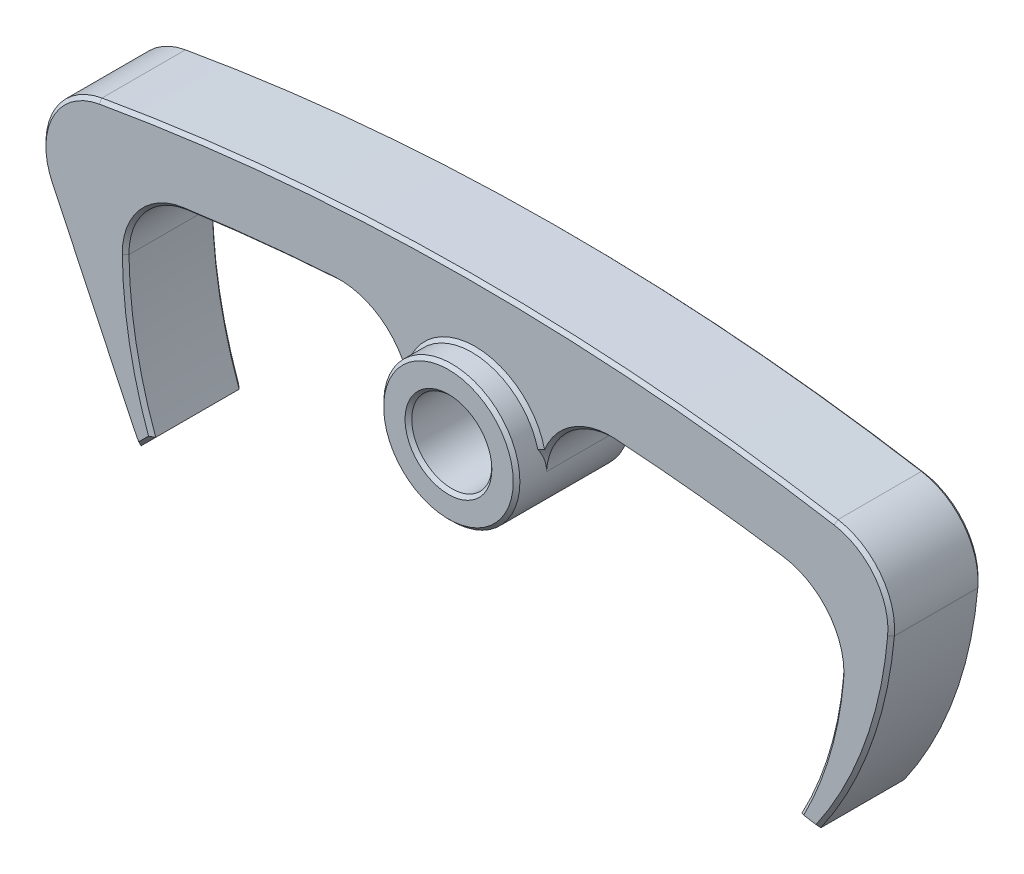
SolidWorks part; units mm, degrees
ref_plane "Спереди" through (0, 0, 0) normal (0, 0, 1) x (1, 0, 0)
ref_plane "Сверху" through (0, 0, 0) normal (0, 1, 0) x (1, 0, 0)
ref_plane "Справа" through (0, 0, 0) normal (1, 0, 0) x (0, 0, -1)
sketch "Эскиз1" plane through (0, 0, 0) normal (0, 0, 1) x (1, 0, 0)
  line L0 (0, 0) -> (0, -9.705) construction
  line L1 (-40.3695, -9.705) -> (40.3695, -9.705) construction
  line L2 (-5.0875, -5) -> (4.1894, -5) construction
  line L3 (24.2206, -22.6439) -> (25.6454, -22.8746)
  line L4 (0, -5) -> (0, -325) construction
  line L5 (-25.2626, -23.5549) -> (-24.1785, -22.4708)
  line L6 (0, -9.705) -> (6.668, -9.705) construction
  line L7 (0, -9.705) -> (0, -11.174) construction
  line L8 (0, -11.174) -> (6.668, -11.174) construction
  line L9 (6.668, -9.705) -> (6.668, -11.174) construction
  line L10 (-31.9088, -9.6434) -> (-26.036, -22.0396)
  arc A0 (26.9243, -2.246) -> (-28.1995, -2.4655) centre (0, -162.5) ccw
  arc A1 (-10.4934, -5.3499) -> (-21.8027, -6.5164) centre (0, -162.5) ccw
  circle A2 centre (0, -9.705) radius 3
  arc A3 (-5.0875, -10.0625) -> (5.0875, -10.0625) centre (0, -9.705) ccw
  circle A4 centre (0, -162.5) radius 157.5 construction
  arc A5 (10.4934, -5.3499) -> (5.0875, -10.0625) centre (10.155, -10.4187) ccw
  arc A6 (-5.0875, -10.0625) -> (-10.4934, -5.3499) centre (-10.155, -10.4187) ccw
  arc A7 (27.3486, -12.1756) -> (23.0321, -6.6932) centre (22.2892, -11.7185) ccw
  circle A8 centre (0, -162.5) radius 162.5 construction
  arc A9 (23.0321, -6.6932) -> (10.4934, -5.3499) centre (0, -162.5) ccw
  arc A10 (25.6454, -22.8746) -> (31.1437, -7.6936) centre (0, -5) ccw
  arc A11 (24.2206, -22.6439) -> (27.3486, -12.1756) centre (0, -9.705) ccw
  arc A12 (26.9243, -2.246) -> (31.1437, -7.6936) centre (26.0826, -7.2558) cw
  arc A13 (-31.9088, -9.6434) -> (-28.1995, -2.4655) centre (-27.3179, -7.4684) cw
  arc A14 (-26.179, -11.6158) -> (-24.1785, -22.4708) centre (6.668, -11.174) ccw
  arc A15 (-26.036, -22.0396) -> (-25.2626, -23.5549) centre (0, -9.705) ccw
  arc A16 (-26.179, -11.6158) -> (-21.8027, -6.5164) centre (-21.0995, -11.5475) cw
  point P24 (27.3627, -7.3951)
  dimension "D1" = 325
  dimension "D4" = 6
  dimension "D5" = 10.2
  dimension "D6" = 10.16
  dimension "D7" = 31.26
  dimension "D9" = 27.46
  dimension "D12" = 5.08
  dimension "D13" = 5.08
  dimension "D14" = 28.81
  dimension "D17" = 65.7
  dimension "D21" = 5.08
  dimension "D3" = 9.705
  dimension "D8" = 5
  dimension "D10" = 80.8
  dimension "D11" = 8.9
  dimension "D15" = 6.668
  dimension "D16" = 1.469
  dimension "D18" = 45
  dimension "D19" = 8.07
  dimension "D20" = 25.349
  dimension "D2" = 5
extrude "Бобышка-Вытянуть1" add sketch "Эскиз1" along normal blind 6.75
sketch "Эскиз2" plane through (0, 0, 6.75) normal (0, 0, 1) x (1, 0, 0)
  circle A0 centre (0, -9.705) radius 3 construction
  circle A1 centre (0, -9.705) radius 3
  circle A2 centre (0, -9.705) radius 5.1
  arc A3 (-5.0875, -10.0625) -> (5.0875, -10.0625) centre (0, -9.705) ccw construction
extrude "Бобышка-Вытянуть2" add sketch "Эскиз2" along normal blind 2
chamfer "Фаска2" distance 0.25 angle 45 8 edges at (-25.6379, -17.1279, 6.75) (-16.1586, -5.8311, 6.75) (-24.9545, -8.2391, 6.75) (26.3105, -17.5669, 6.75) (26.2806, -8.576, 6.75) (16.7762, -5.896, 6.75)
chamfer "Фаска3" distance 0.25 angle 45 29 edges at (-0.6469, -0.0013, 0) (-31.8309, -5.1362, 0) (-28.9724, -15.8415, 0) (-25.6605, -22.803, 0) (-24.7205, -23.0128, 0) (-25.6379, -17.1279, 0) (-24.9545, -8.2391, 0) (-16.1586, -5.8311, 0) (-6.8168, -6.5894, 0) (0, -14.805, 0) (6.8168, -6.5894, 0) (16.7762, -5.896, 0) (26.2806, -8.576, 0) (26.3105, -17.5669, 0) (24.933, -22.7592, 0) (29.3916, -15.6452, 0) (30.0988, -4.1451, 0) (3, -9.705, 8.75) (3, -9.705, 0) (-24.8179, -23.1102, 6.75) (-25.6605, -22.803, 6.75) (-28.9724, -15.8415, 6.75) (-31.8309, -5.1362, 6.75) (-0.6469, -0.0013, 6.75) (30.0988, -4.1451, 6.75) (29.3916, -15.6452, 6.75) (25.0634, -22.7804, 6.75) (5.1, -9.705, 8.75)
